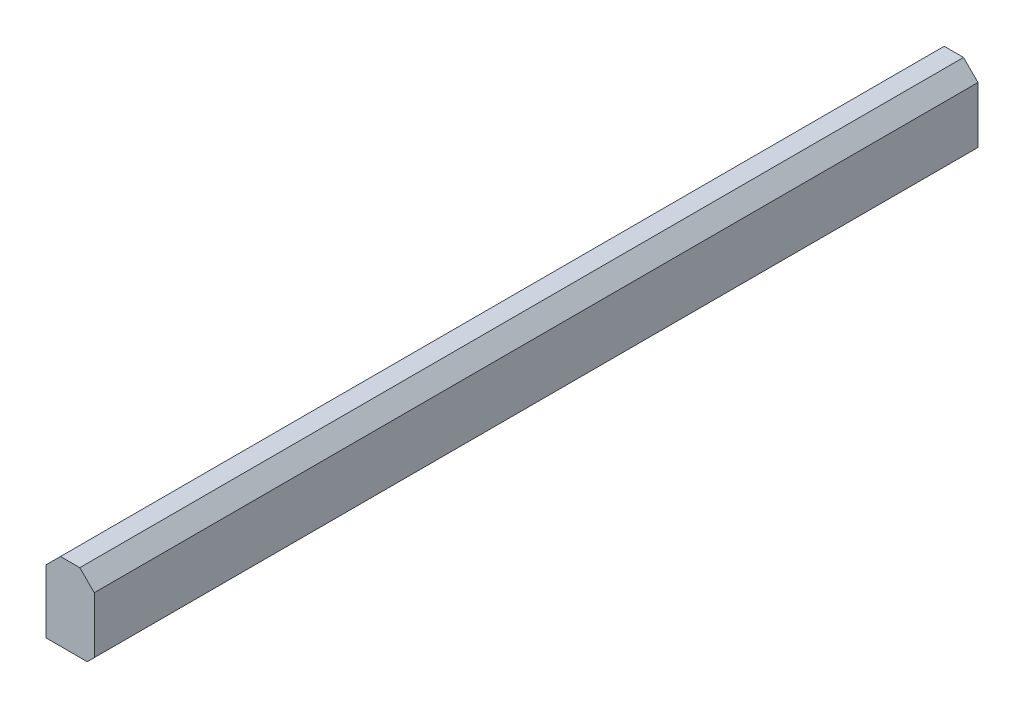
SolidWorks part; units mm, degrees
ref_plane "Front Plane" through (0, 0, 0) normal (1, 0, 0) x (0, 1, 0)
ref_plane "Top Plane" through (0, 0, 0) normal (0, 0, 1) x (0, 1, 0)
ref_plane "Right Plane" through (0, 0, 0) normal (0, 1, 0) x (-1, 0, 0)
sketch "sk w193" plane through (0, 0, 0) normal (0, 0, 1) x (0, 1, 0)
  point P0 (-199.517, -196.596)
  point P2 (0, -196.596)
  point P3 (11.303, 0)
  line B0 (-199.517, -196.596) -> (-199.517, -160.02)
  line B1 (-199.517, -160.02) -> (-26.543, -160.02)
  line B2 (-11.303, -144.78) -> (-11.303, 144.78)
  line B3 (-26.543, 160.02) -> (-199.517, 160.02)
  line B4 (-199.517, 160.02) -> (-199.517, 196.596)
  line B5 (-199.517, 196.596) -> (199.517, 196.596)
  line B6 (199.517, 196.596) -> (199.517, 160.02)
  line B7 (199.517, 160.02) -> (26.543, 160.02)
  line B8 (11.303, 144.78) -> (11.303, -144.78)
  line B9 (26.543, -160.02) -> (199.517, -160.02)
  line B10 (199.517, -160.02) -> (199.517, -196.596)
  line B11 (199.517, -196.596) -> (-199.517, -196.596)
  arc B12 (-26.543, -160.02) -> (-11.303, -144.78) centre (-26.543, -144.78) ccw
  arc B13 (-11.303, 144.78) -> (-26.543, 160.02) centre (-26.543, 144.78) ccw
  arc B14 (26.543, 160.02) -> (11.303, 144.78) centre (26.543, 144.78) ccw
  arc B15 (11.303, -144.78) -> (26.543, -160.02) centre (26.543, -144.78) ccw
sketch_block_instance "w14x193-2"
sketch_block "w14x193" parameters "D4"=15.24, "D1"=399.034, "D2"=393.192, "D3"=22.606, "D5"=36.576
sketch "Sketch2" plane through (0, 0, 0) normal (0, 0, 1) x (0, 1, 0)
  line L1 (-94.107, 58.42) -> (94.107, 58.42)
  line L2 (-94.107, 58.42) -> (-94.107, -58.42)
  line L3 (-94.107, -58.42) -> (94.107, -58.42)
  line L4 (94.107, 58.42) -> (94.107, -58.42)
  line L5 (-94.107, 58.42) -> (94.107, -58.42) construction
  line L6 (-94.107, -58.42) -> (94.107, 58.42) construction
  point P0 (0, 0)
  dimension "D1" = 116.84
  dimension "D2" = 188.214
extrude "Boss-Extrude1" add sketch "Sketch2" along normal mid plane 2139.393
chamfer "Chamfer1" distance 17 angle 45 1 edges at (58.42, -94.107, 0)
chamfer "Chamfer2" distance 35 angle 45 2 edges at (-58.42, 94.107, 0) (58.42, 94.107, 0)
